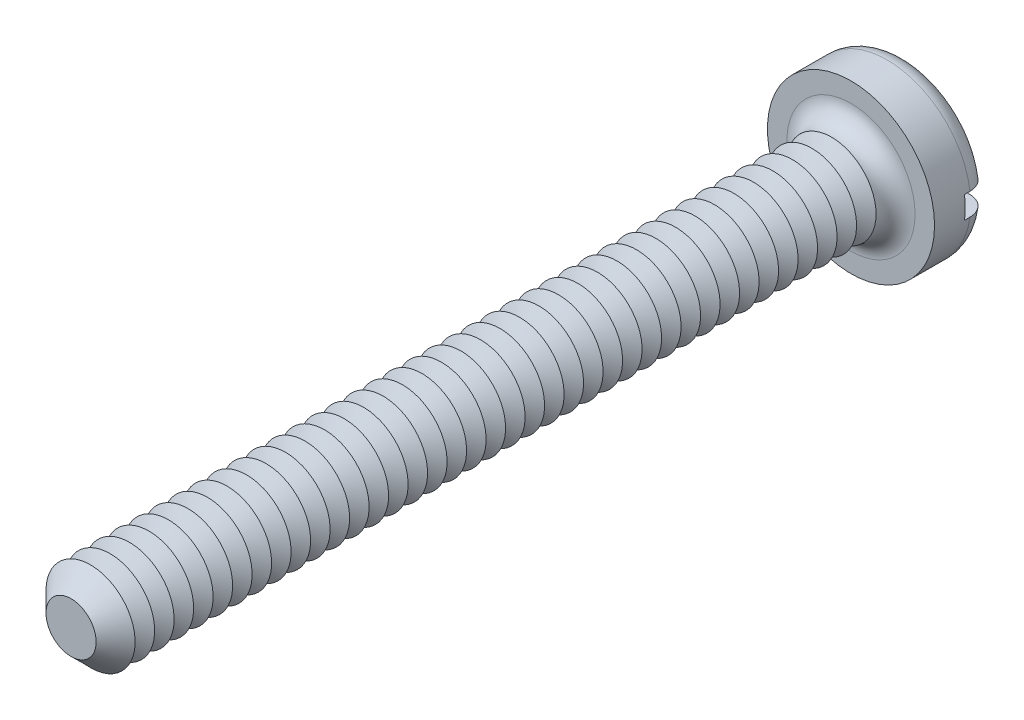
SolidWorks part; units mm, degrees
ref_plane "Front Plane" through (0, 0, 0) normal (0, 0, 1) x (1, 0, 0)
ref_plane "Top Plane" through (0, 0, 0) normal (0, 1, 0) x (1, 0, 0)
ref_plane "Right Plane" through (0, 0, 0) normal (1, 0, 0) x (0, 0, -1)
sketch "Sketch3" plane through (0, 0, 0) normal (0, 0, 1) x (1, 0, 0)
  circle A0 centre (0, 0) radius 1.5
  dimension "D1" = 3
extrude "Boss-Extrude2" add sketch "Sketch3" against normal blind 1
sketch "Sketch4" plane through (0, 0, 0) normal (0, 0, 1) x (1, 0, 0)
  circle A0 centre (0, 0) radius 0.8
  dimension "D1" = 1.6
extrude "Boss-Extrude3" add sketch "Sketch4" along normal blind 14
fillet "Fillet1" radius 0.35 2 edges at (1.5, 0, -1) (0.8, 0, 0)
chamfer "Chamfer1" distance 0.35 angle 45 1 edges at (0.8, 0, 14)
sketch "Sketch5" plane through (0, 0, 0) normal (1, 0, 0) x (0, 0, -1)
  line L0 (1.6944, 0) -> (-7.6738, 0) construction
sketch "Sketch6" plane through (0, 0, 0) normal (1, 0, 0) x (0, 0, -1)
  line L0 (-0.35, 0.8) -> (-0.525, 0.4969)
  line L1 (-0.525, 0.4969) -> (-0.7, 0.8)
  line L2 (-0.35, 0.8) -> (-13.65, 0.8) construction
  line L3 (-0.7, 0.8) -> (-0.35, 0.8)
  dimension "D1" = 0.35
revolve "Cut-Revolve1" cut sketch "Sketch6" angle 360 about L0
pattern_linear "LPattern1" count 38 spacing 0.35 along (0, 0, 1) of "Cut-Revolve1"
sketch "Sketch8" plane through (0, 0, -1) normal (0, 0, -1) x (-1, 0, 0)
  line L1 (1.5, -0.2) -> (-1.5, -0.2)
  line L2 (1.5, -0.2) -> (1.5, 0.2)
  line L3 (1.5, 0.2) -> (-1.5, 0.2)
  line L4 (-1.5, -0.2) -> (-1.5, 0.2)
  line L5 (1.5, -0.2) -> (-1.5, 0.2) construction
  line L6 (1.5, 0.2) -> (-1.5, -0.2) construction
  point P0 (0, 0)
  dimension "D1" = 3
  dimension "D2" = 0.4
extrude "Cut-Extrude1" cut sketch "Sketch8" against normal blind 0.45
